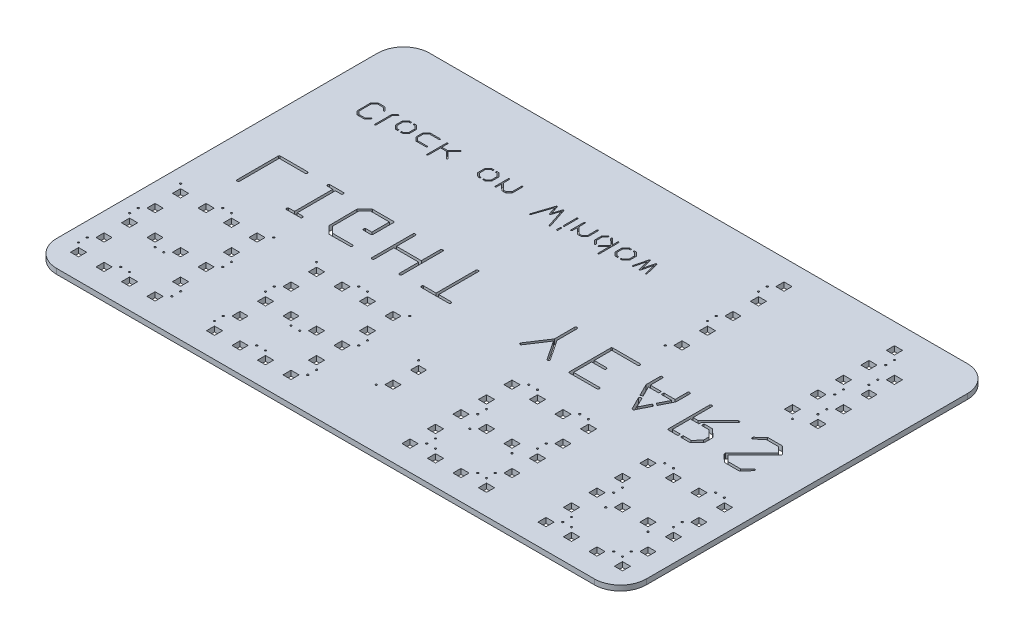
SolidWorks part; units mm, degrees
ref_plane "前视基准面" through (0, 0, 0) normal (0, 0, 1) x (1, 0, 0)
ref_plane "上视基准面" through (0, 0, 0) normal (0, 1, 0) x (1, 0, 0)
ref_plane "右视基准面" through (0, 0, 0) normal (1, 0, 0) x (0, 0, -1)
sketch "草图1" plane through (0, 0, 0) normal (0, 1, 0) x (1, 0, 0)
  line L1 (-170, 107.5) -> (170, 107.5)
  line L2 (-170, 107.5) -> (-170, -107.5)
  line L3 (-170, -107.5) -> (170, -107.5)
  line L4 (170, 107.5) -> (170, -107.5)
  line L5 (-170, 107.5) -> (170, -107.5) construction
  line L6 (-170, -107.5) -> (170, 107.5) construction
  point P0 (0, 0)
  dimension "D1" = 340
  dimension "D2" = 215
extrude "凸台-拉伸1" add sketch "草图1" along normal blind 3
sketch "草图3" plane through (0, 0, 0) normal (0, 1, 0) x (1, 0, 0)
  line L0 (-156.8, -93.1) -> (-112.7, -93.1) construction
  line L1 (-112.7, -93.1) -> (-112.7, -34.3) construction
  line L2 (-112.7, -34.3) -> (-156.8, -34.3) construction
  line L3 (-156.8, -34.3) -> (-156.8, -93.1) construction
  line L4 (-156.8, -63.7) -> (-112.7, -63.7) construction
  line L5 (-78.4, -93.1) -> (-34.3, -93.1) construction
  line L6 (-34.3, -93.1) -> (-34.3, -34.3) construction
  line L7 (-34.3, -34.3) -> (-78.4, -34.3) construction
  line L8 (-78.4, -34.3) -> (-78.4, -93.1) construction
  line L9 (-78.4, -63.7) -> (-34.3, -63.7) construction
  line L10 (34.3, -93.1) -> (78.4, -93.1) construction
  line L11 (78.4, -93.1) -> (78.4, -34.3) construction
  line L12 (78.4, -34.3) -> (34.3, -34.3) construction
  line L13 (34.3, -34.3) -> (34.3, -93.1) construction
  line L14 (34.3, -63.7) -> (78.4, -63.7) construction
  line L15 (112.7, -93.1) -> (156.8, -93.1) construction
  line L16 (156.8, -93.1) -> (156.8, -34.3) construction
  line L17 (156.8, -34.3) -> (112.7, -34.3) construction
  line L18 (112.7, -34.3) -> (112.7, -93.1) construction
  line L19 (112.7, -63.7) -> (156.8, -63.7) construction
  line L22 (-170, 107.5) -> (-170, -107.5) construction
  line L24 (63.7, 34.3) -> (63.7, 93.1) construction
  line L25 (127.4, 34.3) -> (127.4, 93.1) construction
  line L26 (142.1, 34.3) -> (142.1, 78.4) construction
  line L27 (-170, -107.5) -> (170, -107.5) construction
  point P6 (-142.1, -93.1)
  point P7 (-156.8, -93.1)
  point P8 (-127.4, -93.1)
  point P9 (-112.7, -78.4)
  point P10 (-112.7, -93.1)
  point P11 (-112.7, -49)
  point P12 (-127.4, -34.3)
  point P13 (-112.7, -34.3)
  point P14 (-142.1, -34.3)
  point P15 (-156.8, -49)
  point P16 (-156.8, -78.4)
  point P17 (-142.1, -63.7)
  point P18 (-127.4, -63.7)
  point P19 (0, -53.9)
  point P35 (-63.7, -93.1)
  point P36 (-78.4, -93.1)
  point P37 (-49, -93.1)
  point P38 (-34.3, -78.4)
  point P39 (-34.3, -93.1)
  point P40 (-34.3, -49)
  point P41 (-49, -34.3)
  point P42 (-34.3, -34.3)
  point P43 (-63.7, -34.3)
  point P44 (-78.4, -49)
  point P45 (-78.4, -78.4)
  point P46 (-63.7, -63.7)
  point P47 (-49, -63.7)
  point P48 (63.7, 49)
  point P49 (63.7, 34.3)
  point P50 (63.7, 63.7)
  point P57 (49, -93.1)
  point P58 (34.3, -93.1)
  point P59 (63.7, -93.1)
  point P60 (78.4, -78.4)
  point P61 (78.4, -93.1)
  point P62 (78.4, -49)
  point P63 (63.7, -34.3)
  point P64 (78.4, -34.3)
  point P65 (49, -34.3)
  point P66 (34.3, -49)
  point P67 (34.3, -78.4)
  point P68 (49, -63.7)
  point P69 (63.7, -63.7)
  point P70 (63.7, 78.4)
  point P71 (127.4, 49)
  point P72 (63.7, 93.1)
  point P73 (127.4, 34.3)
  point P74 (127.4, 63.7)
  point P75 (127.4, 78.4)
  point P82 (127.4, -93.1)
  point P83 (112.7, -93.1)
  point P84 (142.1, -93.1)
  point P85 (156.8, -78.4)
  point P86 (156.8, -93.1)
  point P87 (156.8, -49)
  point P88 (142.1, -34.3)
  point P89 (156.8, -34.3)
  point P90 (127.4, -34.3)
  point P91 (112.7, -49)
  point P92 (112.7, -78.4)
  point P93 (127.4, -63.7)
  point P94 (142.1, -63.7)
  point P95 (142.1, 49)
  point P96 (127.4, 93.1)
  point P97 (0, -68.6)
  point P98 (142.1, 34.3)
  point P99 (142.1, 63.7)
  point P101 (142.1, 78.4)
  point P102 (-156.8, -63.7)
  point P103 (-112.7, -63.7)
  point P104 (-78.4, -63.7)
  point P105 (-34.3, -63.7)
  point P108 (34.3, -63.7)
  point P109 (78.4, -63.7)
  point P110 (112.7, -63.7)
  point P111 (156.8, -63.7)
  point P112 (-156.8, -34.3)
  point P113 (-78.4, -34.3)
  point P114 (34.3, -34.3)
  point P115 (112.7, -34.3)
  dimension "D1" = 14.7
  dimension "D2" = 14.7
  dimension "D3" = 14.7
  dimension "D4" = 14.7
  dimension "D5" = 14.7
  dimension "D6" = 14.7
  dimension "D7" = 14.7
  dimension "D8" = 14.7
  dimension "D9" = 14.7
  dimension "D10" = 14.7
  dimension "D11" = 14.7
  dimension "D12" = 14.7
  dimension "D13" = 14.7
  dimension "D14" = 14.7
  dimension "D15" = 14.7
  dimension "D16" = 14.7
  dimension "D17" = 14.7
  dimension "D18" = 14.7
  dimension "D19" = 14.7
  dimension "D20" = 14.7
  dimension "D21" = 14.7
  dimension "D22" = 14.7
  dimension "D23" = 14.7
  dimension "D24" = 14.7
  dimension "D25" = 14.7
  dimension "D26" = 14.7
  dimension "D27" = 14.7
  dimension "D28" = 14.7
  dimension "D29" = 34.3
  dimension "D30" = 34.3
  dimension "D31" = 34.3
  dimension "D32" = 34.3
  dimension "D33" = 14.7
  dimension "D34" = 4.9
  dimension "D35" = 13.2
  dimension "D36" = 14.7
  dimension "D37" = 14.7
  dimension "D38" = 14.7
  dimension "D39" = 14.7
  dimension "D40" = 14.7
  dimension "D41" = 14.7
  dimension "D42" = 14.7
  dimension "D43" = 14.7
  dimension "D44" = 14.7
  dimension "D45" = 68.6
  dimension "D46" = 14.4
sketch "草图4" plane through (0, 0, 0) normal (0, -1, 0) x (1, 0, 0)
  line L1 (-159.125, 90.775) -> (-154.475, 90.775)
  line L2 (-159.125, 90.775) -> (-159.125, 95.425)
  line L3 (-159.125, 95.425) -> (-154.475, 95.425)
  line L4 (-154.475, 90.775) -> (-154.475, 95.425)
  line L5 (-159.125, 90.775) -> (-154.475, 95.425) construction
  line L6 (-159.125, 95.425) -> (-154.475, 90.775) construction
  point P0 (-156.8, 93.1)
  point P2 (-156.8, 93.1)
  dimension "D1" = 4.65
extrude "切除-拉伸3" cut sketch "草图4" against normal through all
pattern_sketch "草图阵列1" of "切除-拉伸3"
fillet "圆角1" radius 15 4 edges at (170, 1.5, 107.5) (-170, 1.5, -107.5) (170, 1.5, -107.5) (-170, 1.5, 107.5)
sketch "草图5" plane through (0, 0, 0) normal (0, -1, 0) x (-1, 0, 0)
  line L0 (147, 12.5) -> (-153.7, 12.5) construction
  line L1 (147, 67.5) -> (-21.0459, 67.5) construction
  line L2 (155, -107.5) -> (-155, -107.5) construction
  line L4 (170, 92.5) -> (170, -92.5) construction
  line L5 (147, 67.5) -> (147, 12.5) construction
  line L6 (-155, 107.5) -> (155, 107.5) construction
  line L7 (133.8503, 380.338) -> (658.517, 380.338) construction
  text T0 "LIGHT YEARS" font "SWTxt" height 25
  text T1 "Clock on Window" font "SWTxt" height 12
  point P7 (-3.35, 12.5)
  point P15 (146.9464, 12.5)
  dimension "D1" = 23
  dimension "D2" = 120
  dimension "D4" = 23
  dimension "D5" = 40
extrude "切除-拉伸4" cut sketch "草图5" against normal through all
sketch "草图6" plane through (0, 3, 0) normal (0, 1, 0) x (1, 0, 0)
  line L0 (132.225, 27.1414) -> (132.225, 99.9513) construction
  line L1 (137.275, 27.1414) -> (137.275, 84.9061) construction
  line L2 (58.875, 27.1414) -> (58.875, 99.9513) construction
  line L3 (151.975, -102.1037) -> (151.975, -26.325) construction
  line L4 (146.925, -102.1037) -> (146.925, -26.325) construction
  line L5 (122.575, -100.8558) -> (122.575, -25.0771) construction
  line L6 (117.525, -100.8558) -> (117.525, -25.0771) construction
  line L7 (73.575, -100.8558) -> (73.575, -25.0771) construction
  line L8 (68.525, -100.8558) -> (68.525, -25.0771) construction
  line L9 (44.175, -100.8558) -> (44.175, -25.0771) construction
  line L10 (39.125, -100.8558) -> (39.125, -25.0771) construction
  line L11 (-4.825, -77.8943) -> (-4.825, -40.392) construction
  line L12 (-29.475, -100.8558) -> (-29.475, -25.0771) construction
  line L13 (-53.825, -101.9343) -> (-53.825, -26.1556) construction
  line L14 (-58.875, -101.9343) -> (-58.875, -26.1556) construction
  line L15 (-83.225, -101.9343) -> (-83.225, -26.1556) construction
  line L16 (-107.875, -101.9343) -> (-107.875, -26.1556) construction
  line L17 (-132.225, -101.9343) -> (-132.225, -26.1556) construction
  line L18 (-137.275, -101.9343) -> (-137.275, -26.1556) construction
  line L19 (-161.625, -101.9343) -> (-161.625, -26.1556) construction
  line L20 (139.775, 31.975) -> (139.775, 36.625) construction
  line L21 (129.725, 36.625) -> (129.725, 31.975) construction
  line L22 (61.375, 31.975) -> (61.375, 36.625) construction
  line L23 (154.475, -36.625) -> (154.475, -31.975) construction
  line L24 (144.425, -31.975) -> (144.425, -36.625) construction
  line L26 (163.3271, -29.475) -> (-166.9057, -29.475) construction
  line L27 (154.475, -31.975) -> (159.125, -31.975) construction
  line L28 (125.075, -36.625) -> (125.075, -31.975) construction
  line L29 (115.025, -31.975) -> (115.025, -36.625) construction
  line L30 (76.075, -36.625) -> (76.075, -31.975) construction
  line L31 (66.025, -31.975) -> (66.025, -36.625) construction
  line L32 (46.675, -36.625) -> (46.675, -31.975) construction
  line L33 (36.625, -31.975) -> (36.625, -36.625) construction
  line L34 (-2.325, -70.925) -> (-2.325, -66.275) construction
  line L35 (-31.975, -31.975) -> (-31.975, -36.625) construction
  line L36 (-51.325, -36.625) -> (-51.325, -31.975) construction
  line L37 (-61.375, -31.975) -> (-61.375, -36.625) construction
  line L38 (-80.725, -36.625) -> (-80.725, -31.975) construction
  line L39 (-110.375, -31.975) -> (-110.375, -36.625) construction
  line L40 (-129.725, -36.625) -> (-129.725, -31.975) construction
  line L41 (-139.775, -31.975) -> (-139.775, -36.625) construction
  line L42 (-159.125, -36.625) -> (-159.125, -31.975) construction
  line L43 (163.3271, -53.825) -> (-166.9057, -53.825) construction
  line L44 (-154.475, -51.325) -> (-159.125, -51.325) construction
  line L45 (163.3271, -58.875) -> (-166.9057, -58.875) construction
  line L46 (-159.125, -61.375) -> (-154.475, -61.375) construction
  line L47 (163.3271, -68.525) -> (-166.9057, -68.525) construction
  line L48 (159.125, -66.025) -> (154.475, -66.025) construction
  line L49 (163.3271, -83.225) -> (-166.9057, -83.225) construction
  line L50 (159.125, -80.725) -> (154.475, -80.725) construction
  line L51 (163.3271, -88.275) -> (-166.9057, -88.275) construction
  line L52 (154.475, -90.775) -> (159.125, -90.775) construction
  line L53 (2.325, -70.925) -> (-2.325, -70.925) construction
  line L54 (-2.325, -51.575) -> (2.325, -51.575) construction
  line L55 (134.7764, 29.475) -> (55.3696, 29.475) construction
  line L56 (129.725, 31.975) -> (125.075, 31.975) construction
  line L57 (134.7764, 53.825) -> (55.3696, 53.825) construction
  line L58 (125.075, 51.325) -> (129.725, 51.325) construction
  line L59 (134.7764, 58.875) -> (55.3696, 58.875) construction
  line L60 (129.725, 61.375) -> (125.075, 61.375) construction
  line L61 (134.7764, 83.225) -> (55.3696, 83.225) construction
  line L62 (125.075, 80.725) -> (129.725, 80.725) construction
  line L63 (134.7764, 88.275) -> (55.3696, 88.275) construction
  line L64 (129.725, 90.775) -> (125.075, 90.775) construction
  line L65 (139.775, 36.625) -> (144.425, 36.625) construction
  line L66 (144.425, 46.675) -> (139.775, 46.675) construction
  line L67 (139.775, 66.025) -> (144.425, 66.025) construction
  line L68 (144.425, 76.075) -> (139.775, 76.075) construction
  circle A0 centre (137.275, 73.575) radius 0.5
  circle A1 centre (137.275, 68.525) radius 0.5
  circle A2 centre (137.275, 44.175) radius 0.5
  circle A3 centre (137.275, 39.125) radius 0.5
  circle A4 centre (132.225, 88.275) radius 0.5
  circle A5 centre (132.225, 83.225) radius 0.5
  circle A6 centre (132.225, 58.875) radius 0.5
  circle A7 centre (132.225, 53.825) radius 0.5
  circle A8 centre (132.225, 29.475) radius 0.5
  circle A9 centre (58.875, 88.275) radius 0.5
  circle A10 centre (58.875, 83.225) radius 0.5
  circle A11 centre (58.875, 58.875) radius 0.5
  circle A12 centre (58.875, 53.825) radius 0.5
  circle A13 centre (58.875, 29.475) radius 0.5
  circle A14 centre (151.975, -29.475) radius 0.5
  circle A15 centre (151.975, -53.825) radius 0.5
  circle A16 centre (151.975, -58.875) radius 0.5
  circle A17 centre (151.975, -83.225) radius 0.5
  circle A18 centre (151.975, -88.275) radius 0.5
  circle A19 centre (146.925, -88.275) radius 0.5
  circle A20 centre (146.925, -68.525) radius 0.5
  circle A21 centre (146.925, -29.475) radius 0.5
  circle A22 centre (122.575, -29.475) radius 0.5
  circle A23 centre (122.575, -68.525) radius 0.5
  circle A24 centre (122.575, -88.275) radius 0.5
  circle A25 centre (117.525, -88.275) radius 0.5
  circle A26 centre (117.525, -83.225) radius 0.5
  circle A27 centre (117.525, -58.875) radius 0.5
  circle A28 centre (117.525, -53.825) radius 0.5
  circle A29 centre (117.525, -29.475) radius 0.5
  circle A30 centre (73.575, -88.275) radius 0.5
  circle A31 centre (73.575, -83.225) radius 0.5
  circle A32 centre (73.575, -58.875) radius 0.5
  circle A33 centre (73.575, -53.825) radius 0.5
  circle A34 centre (73.575, -29.475) radius 0.5
  circle A35 centre (68.525, -88.275) radius 0.5
  circle A36 centre (68.525, -68.525) radius 0.5
  circle A37 centre (68.525, -29.475) radius 0.5
  circle A38 centre (44.175, -88.275) radius 0.5
  circle A39 centre (44.175, -68.525) radius 0.5
  circle A40 centre (44.175, -29.475) radius 0.5
  circle A41 centre (39.125, -29.475) radius 0.5
  circle A42 centre (39.125, -53.825) radius 0.5
  circle A43 centre (39.125, -58.875) radius 0.5
  circle A44 centre (39.125, -83.225) radius 0.5
  circle A45 centre (39.125, -88.275) radius 0.5
  circle A46 centre (-4.825, -73.425) radius 0.5
  circle A47 centre (-4.825, -49.075) radius 0.5
  circle A48 centre (-29.475, -88.275) radius 0.5
  circle A49 centre (-29.475, -83.225) radius 0.5
  circle A50 centre (-29.475, -58.875) radius 0.5
  circle A51 centre (-29.475, -53.825) radius 0.5
  circle A52 centre (-29.475, -29.475) radius 0.5
  circle A53 centre (-53.825, -88.275) radius 0.5
  circle A54 centre (-53.825, -68.525) radius 0.5
  circle A55 centre (-53.825, -29.475) radius 0.5
  circle A56 centre (-58.875, -88.275) radius 0.5
  circle A57 centre (-58.875, -68.525) radius 0.5
  circle A58 centre (-58.875, -29.475) radius 0.5
  circle A59 centre (-83.225, -88.275) radius 0.5
  circle A60 centre (-83.225, -83.225) radius 0.5
  circle A61 centre (-83.225, -58.875) radius 0.5
  circle A62 centre (-83.225, -53.825) radius 0.5
  circle A63 centre (-83.225, -29.475) radius 0.5
  circle A64 centre (-107.875, -88.275) radius 0.5
  circle A65 centre (-107.875, -83.225) radius 0.5
  circle A66 centre (-107.875, -58.875) radius 0.5
  circle A67 centre (-107.875, -53.825) radius 0.5
  circle A68 centre (-107.875, -29.475) radius 0.5
  circle A69 centre (-132.225, -88.275) radius 0.5
  circle A70 centre (-132.225, -68.525) radius 0.5
  circle A71 centre (-132.225, -29.475) radius 0.5
  circle A72 centre (-137.275, -88.275) radius 0.5
  circle A73 centre (-137.275, -68.525) radius 0.5
  circle A74 centre (-137.275, -29.475) radius 0.5
  circle A75 centre (-161.625, -88.275) radius 0.5
  circle A76 centre (-161.625, -83.225) radius 0.5
  circle A77 centre (-161.625, -58.875) radius 0.5
  circle A78 centre (-161.625, -53.825) radius 0.5
  circle A79 centre (-161.625, -29.475) radius 0.5
  point P256 (-156.8, -61.375)
  point P287 (127.4, 80.725)
  dimension "D1" = 1
  dimension "D2" = 2.5
  dimension "D3" = 2.5
  dimension "D4" = 2.5
  dimension "D5" = 2.5
  dimension "D6" = 2.5
  dimension "D7" = 2.5
  dimension "D8" = 2.5
  dimension "D9" = 2.5
  dimension "D10" = 2.5
  dimension "D11" = 2.5
  dimension "D12" = 2.5
  dimension "D13" = 2.5
  dimension "D14" = 2.5
  dimension "D15" = 2.5
  dimension "D16" = 2.5
  dimension "D17" = 2.5
  dimension "D18" = 2.5
  dimension "D19" = 2.5
  dimension "D20" = 2.5
  dimension "D21" = 2.5
  dimension "D22" = 2.5
  dimension "D23" = 2.5
  dimension "D24" = 2.5
  dimension "D25" = 2.5
  dimension "D26" = 2.5
  dimension "D27" = 2.5
  dimension "D28" = 2.5
  dimension "D29" = 2.5
  dimension "D30" = 2.5
  dimension "D31" = 2.5
  dimension "D32" = 2.5
  dimension "D33" = 2.5
  dimension "D34" = 2.5
  dimension "D35" = 2.5
  dimension "D36" = 2.5
  dimension "D37" = 2.5
  dimension "D38" = 2.5
sketch "草图7" plane through (0, 0, 0) normal (0, -1, 0) x (1, 0, 0)
  line L0 (77.138, 4.095) -> (76.4638, 2.7551)
  line L1 (77.138, 4.095) -> (78.446, 3.4369)
  line L2 (76.4638, 2.7551) -> (77.7718, 2.097)
  line L3 (78.446, 3.4369) -> (77.7718, 2.097)
  line L4 (72.9052, -4.3434) -> (80.8851, 11.5653) construction
  line L5 (81.4478, 9.4029) -> (74.77, -3.869) construction
  line L6 (84.4668, 3.4361) -> (85.1439, 2.0977)
  line L7 (84.4668, 3.4361) -> (85.867, 4.1446)
  line L8 (85.1439, 2.0977) -> (86.5442, 2.8062)
  line L9 (-123.0802, -60.3571) -> (-126.5802, -60.3571) construction
  line L10 (85.867, 4.1446) -> (86.5442, 2.8062)
  line L11 (88.1629, -3.869) -> (81.4478, 9.4029) construction
  line L12 (-124.0584, -60.3571) -> (-125.5584, -60.3571)
  line L13 (3.6395, -60.3571) -> (0.1395, -60.3571) construction
  line L14 (82.1547, 11.5327) -> (90.1671, -4.4131) construction
  line L15 (80.7164, -3.869) -> (82.2164, -3.869)
  line L16 (80.7164, -3.869) -> (80.7164, -5.3571)
  line L17 (82.2164, -3.869) -> (82.2164, -5.3571)
  line L18 (80.7164, -5.3571) -> (82.2164, -5.3571)
  line L19 (74.77, -3.869) -> (88.1629, -3.869) construction
  line L20 (88.679, -5.3571) -> (74.3933, -5.3571) construction
  line L21 (107.5303, 10.4167) -> (109.0303, 10.4167)
  line L22 (107.5303, 10.4167) -> (107.5303, 11.8908)
  line L23 (109.0303, 10.4167) -> (109.0303, 11.8908)
  line L24 (107.5303, 11.8908) -> (109.0303, 11.8908)
  line L25 (113.6746, 10.4167) -> (102.886, 10.4167) construction
  line L26 (102.5604, 11.8722) -> (113.9072, 11.9048) construction
  line L27 (107.7734, 0) -> (109.2734, 0)
  line L28 (107.7734, 0) -> (107.7734, -1.4881)
  line L29 (109.2734, 0) -> (109.2734, -1.4881)
  line L30 (107.7734, -1.4881) -> (109.2734, -1.4881)
  line L31 (102.886, 0) -> (113.6421, 0) construction
  line L32 (114.0095, -1.4881) -> (107.7734, -1.4881) construction
  line L33 (-125.5556, -59.6477) -> (-124.0556, -59.6536)
  line L34 (-125.5556, -59.6477) -> (-125.5584, -60.3571)
  line L35 (-124.0556, -59.6536) -> (-124.0584, -60.3571)
  line L36 (-125.5877, -67.7857) -> (-124.0876, -67.7857)
  line L37 (-126.79, -59.6429) -> (-122.8213, -59.6585) construction
  line L38 (-122.9351, -67.7857) -> (-126.857, -67.7857) construction
  line L39 (-78.0731, -59.6477) -> (-76.5731, -59.6536)
  line L40 (-78.0731, -59.6477) -> (-78.0759, -60.3571)
  line L41 (-76.5731, -59.6536) -> (-76.5759, -60.3571)
  line L42 (-78.1052, -67.7857) -> (-76.6052, -67.7857)
  line L43 (-79.3075, -59.6429) -> (-75.3388, -59.6585) construction
  line L44 (0.1395, -67.0714) -> (3.6395, -67.0714) construction
  line L45 (-10.1373, -60.3571) -> (-11.74, -60.3571) construction
  line L46 (-75.4526, -67.7857) -> (-79.3745, -67.7857) construction
  line L47 (-11.6518, -59.6447) -> (-10.1519, -59.6566)
  line L48 (-11.6518, -59.6447) -> (-11.6575, -60.3571)
  line L49 (-10.1519, -59.6566) -> (-10.1575, -60.3571)
  line L50 (-11.7167, -67.7857) -> (-10.2166, -67.7857)
  line L51 (-11.8829, -59.6429) -> (-9.9208, -59.6585) construction
  line L52 (-9.9543, -67.7857) -> (-12.0146, -67.7857) construction
  line L53 (1.1641, -59.6477) -> (2.6641, -59.6536)
  line L54 (1.1641, -59.6477) -> (1.1613, -60.3571)
  line L55 (2.6641, -59.6536) -> (2.6613, -60.3571)
  line L56 (1.132, -67.7857) -> (2.6321, -67.7857)
  line L57 (-0.0703, -59.6429) -> (3.8985, -59.6585) construction
  line L58 (3.7846, -67.7857) -> (-0.1373, -67.7857) construction
  line L59 (-11.74, -67.0714) -> (-10.153, -67.0714) construction
  line L60 (-79.0977, -67.0714) -> (-75.5977, -67.0714) construction
  line L61 (-75.5977, -60.3571) -> (-79.0977, -60.3571) construction
  line L62 (-126.5802, -67.0714) -> (-123.0802, -67.0714) construction
  line L63 (2.6613, -60.3571) -> (1.1613, -60.3571)
  line L64 (1.1349, -67.0714) -> (2.6349, -67.0714)
  line L65 (-10.1575, -60.3571) -> (-11.6575, -60.3571)
  line L66 (-11.711, -67.0714) -> (-10.2109, -67.0714)
  line L67 (-78.1024, -67.0714) -> (-76.6023, -67.0714)
  line L68 (-76.5759, -60.3571) -> (-78.0759, -60.3571)
  line L69 (-125.5849, -67.0714) -> (-124.0848, -67.0714)
  line L70 (2.6349, -67.0714) -> (2.6321, -67.7857)
  line L71 (1.1349, -67.0714) -> (1.132, -67.7857)
  line L72 (-10.2109, -67.0714) -> (-10.2166, -67.7857)
  line L73 (-11.711, -67.0714) -> (-11.7167, -67.7857)
  line L74 (-76.6023, -67.0714) -> (-76.6052, -67.7857)
  line L75 (-78.1024, -67.0714) -> (-78.1052, -67.7857)
  line L76 (-124.0848, -67.0714) -> (-124.0876, -67.7857)
  line L77 (-125.5849, -67.0714) -> (-125.5877, -67.7857)
  circle A1 centre (137.275, -39.125) radius 0.5
  circle A2 centre (137.275, -39.125) radius 0.5
  circle A3 centre (137.275, -44.175) radius 0.5
  circle A4 centre (137.275, -44.175) radius 0.5
  circle A5 centre (137.275, -68.525) radius 0.5
  circle A6 centre (137.275, -68.525) radius 0.5
  circle A7 centre (137.275, -73.575) radius 0.5
  circle A8 centre (137.275, -73.575) radius 0.5
  circle A9 centre (58.875, -83.225) radius 0.5
  circle A10 centre (58.875, -83.225) radius 0.5
  circle A11 centre (58.875, -88.275) radius 0.5
  circle A12 centre (58.875, -88.275) radius 0.5
  circle A13 centre (132.225, -29.475) radius 0.5
  circle A14 centre (132.225, -29.475) radius 0.5
  circle A15 centre (132.225, -53.825) radius 0.5
  circle A16 centre (132.225, -53.825) radius 0.5
  circle A17 centre (132.225, -58.875) radius 0.5
  circle A18 centre (132.225, -58.875) radius 0.5
  circle A19 centre (132.225, -83.225) radius 0.5
  circle A20 centre (132.225, -83.225) radius 0.5
  circle A21 centre (132.225, -88.275) radius 0.5
  circle A22 centre (132.225, -88.275) radius 0.5
  circle A23 centre (151.975, 88.275) radius 0.5
  circle A24 centre (151.975, 88.275) radius 0.5
  circle A25 centre (151.975, 83.225) radius 0.5
  circle A26 centre (151.975, 83.225) radius 0.5
  circle A27 centre (151.975, 58.875) radius 0.5
  circle A28 centre (151.975, 58.875) radius 0.5
  circle A29 centre (151.975, 53.825) radius 0.5
  circle A30 centre (151.975, 53.825) radius 0.5
  circle A31 centre (151.975, 29.475) radius 0.5
  circle A32 centre (151.975, 29.475) radius 0.5
  circle A33 centre (58.875, -29.475) radius 0.5
  circle A34 centre (58.875, -29.475) radius 0.5
  circle A35 centre (58.875, -53.825) radius 0.5
  circle A36 centre (58.875, -53.825) radius 0.5
  circle A37 centre (58.875, -58.875) radius 0.5
  circle A38 centre (58.875, -58.875) radius 0.5
  circle A39 centre (117.525, 83.225) radius 0.5
  circle A40 centre (117.525, 83.225) radius 0.5
  circle A41 centre (117.525, 88.275) radius 0.5
  circle A42 centre (117.525, 88.275) radius 0.5
  circle A43 centre (122.575, 88.275) radius 0.5
  circle A44 centre (122.575, 88.275) radius 0.5
  circle A45 centre (122.575, 68.525) radius 0.5
  circle A46 centre (122.575, 68.525) radius 0.5
  circle A47 centre (122.575, 29.475) radius 0.5
  circle A48 centre (122.575, 29.475) radius 0.5
  circle A49 centre (146.925, 29.475) radius 0.5
  circle A50 centre (146.925, 29.475) radius 0.5
  circle A51 centre (146.925, 68.525) radius 0.5
  circle A52 centre (146.925, 68.525) radius 0.5
  circle A53 centre (146.925, 88.275) radius 0.5
  circle A54 centre (146.925, 88.275) radius 0.5
  circle A55 centre (73.575, 29.475) radius 0.5
  circle A56 centre (73.575, 29.475) radius 0.5
  circle A57 centre (73.575, 53.825) radius 0.5
  circle A58 centre (73.575, 53.825) radius 0.5
  circle A59 centre (73.575, 58.875) radius 0.5
  circle A60 centre (73.575, 58.875) radius 0.5
  circle A61 centre (73.575, 83.225) radius 0.5
  circle A62 centre (73.575, 83.225) radius 0.5
  circle A63 centre (73.575, 88.275) radius 0.5
  circle A64 centre (73.575, 88.275) radius 0.5
  circle A65 centre (117.525, 29.475) radius 0.5
  circle A66 centre (117.525, 29.475) radius 0.5
  circle A67 centre (117.525, 53.825) radius 0.5
  circle A68 centre (117.525, 53.825) radius 0.5
  circle A69 centre (117.525, 58.875) radius 0.5
  circle A70 centre (117.525, 58.875) radius 0.5
  circle A71 centre (39.125, 53.825) radius 0.5
  circle A72 centre (39.125, 53.825) radius 0.5
  circle A73 centre (39.125, 29.475) radius 0.5
  circle A74 centre (39.125, 29.475) radius 0.5
  circle A75 centre (44.175, 29.475) radius 0.5
  circle A76 centre (44.175, 29.475) radius 0.5
  circle A77 centre (44.175, 68.525) radius 0.5
  circle A78 centre (44.175, 68.525) radius 0.5
  circle A79 centre (44.175, 88.275) radius 0.5
  circle A80 centre (44.175, 88.275) radius 0.5
  circle A81 centre (68.525, 29.475) radius 0.5
  circle A82 centre (68.525, 29.475) radius 0.5
  circle A83 centre (68.525, 68.525) radius 0.5
  circle A84 centre (68.525, 68.525) radius 0.5
  circle A85 centre (68.525, 88.275) radius 0.5
  circle A86 centre (68.525, 88.275) radius 0.5
  circle A87 centre (-29.475, 58.875) radius 0.5
  circle A88 centre (-29.475, 58.875) radius 0.5
  circle A89 centre (-29.475, 83.225) radius 0.5
  circle A90 centre (-29.475, 83.225) radius 0.5
  circle A91 centre (-29.475, 88.275) radius 0.5
  circle A92 centre (-29.475, 88.275) radius 0.5
  circle A93 centre (-4.825, 49.075) radius 0.5
  circle A94 centre (-4.825, 49.075) radius 0.5
  circle A95 centre (-4.825, 73.425) radius 0.5
  circle A96 centre (-4.825, 73.425) radius 0.5
  circle A97 centre (39.125, 88.275) radius 0.5
  circle A98 centre (39.125, 88.275) radius 0.5
  circle A99 centre (39.125, 83.225) radius 0.5
  circle A100 centre (39.125, 83.225) radius 0.5
  circle A101 centre (39.125, 58.875) radius 0.5
  circle A102 centre (39.125, 58.875) radius 0.5
  circle A103 centre (-58.875, 29.475) radius 0.5
  circle A104 centre (-58.875, 29.475) radius 0.5
  circle A105 centre (-58.875, 68.525) radius 0.5
  circle A106 centre (-58.875, 68.525) radius 0.5
  circle A107 centre (-58.875, 88.275) radius 0.5
  circle A108 centre (-58.875, 88.275) radius 0.5
  circle A109 centre (-53.825, 29.475) radius 0.5
  circle A110 centre (-53.825, 29.475) radius 0.5
  circle A111 centre (-53.825, 68.525) radius 0.5
  circle A112 centre (-53.825, 68.525) radius 0.5
  circle A113 centre (-53.825, 88.275) radius 0.5
  circle A114 centre (-53.825, 88.275) radius 0.5
  circle A115 centre (-29.475, 29.475) radius 0.5
  circle A116 centre (-29.475, 29.475) radius 0.5
  circle A117 centre (-29.475, 53.825) radius 0.5
  circle A118 centre (-29.475, 53.825) radius 0.5
  circle A119 centre (-107.875, 58.875) radius 0.5
  circle A120 centre (-107.875, 58.875) radius 0.5
  circle A121 centre (-107.875, 83.225) radius 0.5
  circle A122 centre (-107.875, 83.225) radius 0.5
  circle A123 centre (-107.875, 88.275) radius 0.5
  circle A124 centre (-107.875, 88.275) radius 0.5
  circle A125 centre (-83.225, 29.475) radius 0.5
  circle A126 centre (-83.225, 29.475) radius 0.5
  circle A127 centre (-83.225, 53.825) radius 0.5
  circle A128 centre (-83.225, 53.825) radius 0.5
  circle A129 centre (-83.225, 58.875) radius 0.5
  circle A130 centre (-83.225, 58.875) radius 0.5
  circle A131 centre (-83.225, 83.225) radius 0.5
  circle A132 centre (-83.225, 83.225) radius 0.5
  circle A133 centre (-83.225, 88.275) radius 0.5
  circle A134 centre (-83.225, 88.275) radius 0.5
  circle A135 centre (-137.275, 29.475) radius 0.5
  circle A136 centre (-137.275, 29.475) radius 0.5
  circle A137 centre (-137.275, 68.525) radius 0.5
  circle A138 centre (-137.275, 68.525) radius 0.5
  circle A139 centre (-137.275, 88.275) radius 0.5
  circle A140 centre (-137.275, 88.275) radius 0.5
  circle A141 centre (-132.225, 29.475) radius 0.5
  circle A142 centre (-132.225, 29.475) radius 0.5
  circle A143 centre (-132.225, 68.525) radius 0.5
  circle A144 centre (-132.225, 68.525) radius 0.5
  circle A145 centre (-132.225, 88.275) radius 0.5
  circle A146 centre (-132.225, 88.275) radius 0.5
  circle A147 centre (-107.875, 29.475) radius 0.5
  circle A148 centre (-107.875, 29.475) radius 0.5
  circle A149 centre (-107.875, 53.825) radius 0.5
  circle A150 centre (-107.875, 53.825) radius 0.5
  circle A151 centre (-161.625, 29.475) radius 0.5
  circle A152 centre (-161.625, 29.475) radius 0.5
  circle A153 centre (-161.625, 53.825) radius 0.5
  circle A154 centre (-161.625, 53.825) radius 0.5
  circle A155 centre (-161.625, 58.875) radius 0.5
  circle A156 centre (-161.625, 58.875) radius 0.5
  circle A157 centre (-161.625, 83.225) radius 0.5
  circle A158 centre (-161.625, 83.225) radius 0.5
  circle A159 centre (-161.625, 88.275) radius 0.5
  circle A160 centre (-161.625, 88.275) radius 0.5
  point P9 (78.1089, 2.7669)
  point P18 (84.8053, 2.7669)
  point P27 (81.4664, -3.869)
  point P36 (108.2803, 10.4167)
  point P45 (108.264, 0)
  point P55 (-124.8056, -59.6507)
  point P64 (-77.3231, -59.6507)
  point P73 (-10.9019, -59.6507)
  point P79 (0, 0)
  point P82 (1.9141, -59.6507)
  dimension "D1" = 1.5
  dimension "D2" = 1.5
  dimension "D3" = 1.5
  dimension "D4" = 1.5
  dimension "D5" = 1.5
  dimension "D6" = 1.5
  dimension "D7" = 1.5
  dimension "D8" = 1.5
  dimension "D89" = 1.5
  dimension "D9" = 0
  dimension "D10" = 0
  dimension "D11" = 0
  dimension "D12" = 0
  dimension "D13" = 0
  dimension "D14" = 0
  dimension "D15" = 0
  dimension "D16" = 0
  dimension "D17" = 0
  dimension "D18" = 0
  dimension "D19" = 0
  dimension "D20" = 0
  dimension "D21" = 0
  dimension "D22" = 0
  dimension "D23" = 0
  dimension "D24" = 0
  dimension "D25" = 0
  dimension "D26" = 0
  dimension "D27" = 0
  dimension "D28" = 0
  dimension "D29" = 0
  dimension "D30" = 0
  dimension "D31" = 0
  dimension "D32" = 0
  dimension "D33" = 0
  dimension "D34" = 0
  dimension "D35" = 0
  dimension "D36" = 0
  dimension "D37" = 0
  dimension "D38" = 0
  dimension "D39" = 0
  dimension "D40" = 0
  dimension "D41" = 0
  dimension "D42" = 0
  dimension "D43" = 0
  dimension "D44" = 0
  dimension "D45" = 0
  dimension "D46" = 0
  dimension "D47" = 0
  dimension "D48" = 0
  dimension "D49" = 0
  dimension "D50" = 0
  dimension "D51" = 0
  dimension "D52" = 0
  dimension "D53" = 0
  dimension "D54" = 0
  dimension "D55" = 0
  dimension "D56" = 0
  dimension "D57" = 0
  dimension "D58" = 0
  dimension "D59" = 0
  dimension "D60" = 0
  dimension "D61" = 0
  dimension "D62" = 0
  dimension "D63" = 0
  dimension "D64" = 0
  dimension "D65" = 0
  dimension "D66" = 0
  dimension "D67" = 0
  dimension "D68" = 0
  dimension "D69" = 0
  dimension "D70" = 0
  dimension "D71" = 0
  dimension "D72" = 0
  dimension "D73" = 0
  dimension "D74" = 0
  dimension "D75" = 0
  dimension "D76" = 0
  dimension "D77" = 0
  dimension "D78" = 0
  dimension "D79" = 0
  dimension "D80" = 0
  dimension "D81" = 0
  dimension "D82" = 0
  dimension "D83" = 0
  dimension "D84" = 0
  dimension "D85" = 0
  dimension "D86" = 0
  dimension "D87" = 0
  dimension "D88" = 0
extrude "凸台-拉伸9" add sketch "草图7" against normal through all
extrude "切除-拉伸7" cut sketch "草图6" against normal through all
